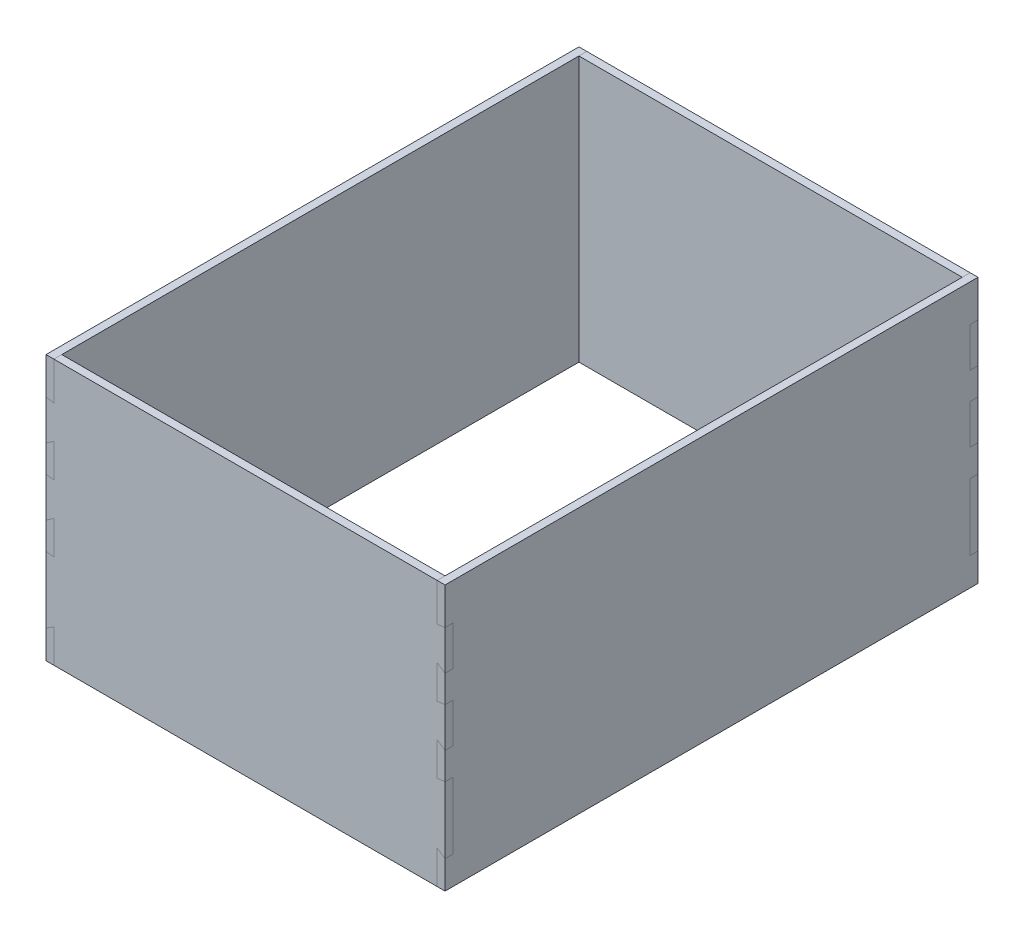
SolidWorks part; units mm, degrees
ref_plane "Front Plane" through (0, 0, 0) normal (0, 0, 1) x (1, 0, 0)
ref_plane "Top Plane" through (0, 0, 0) normal (0, 1, 0) x (1, 0, 0)
ref_plane "Right Plane" through (0, 0, 0) normal (1, 0, 0) x (0, 0, -1)
sketch "Sketch1" plane through (0, 0, 0) normal (0, 0, 1) x (1, 0, 0)
  line L1 (-132.5632, 48.0132) -> (-56.5632, 48.0132)
  line L2 (-132.5632, 48.0132) -> (-132.5632, -52.9868)
  line L3 (-132.5632, -52.9868) -> (-56.5632, -52.9868)
  line L4 (-56.5632, 48.0132) -> (-56.5632, -52.9868)
extrude "Boss-Extrude1" add sketch "Sketch1" along normal blind 3
sketch "Sketch2" plane through (0, 0, 3) normal (0, 0, 1) x (1, 0, 0)
  line L0 (-132.5632, 48.0132) -> (-129.5632, 48.0132)
  line L1 (-56.5632, 48.0132) -> (-132.5632, 48.0132) construction
  line L2 (-129.5632, 48.0132) -> (-129.5632, 33.5846)
  line L3 (-129.5632, 33.5846) -> (-132.5632, 33.9596)
  line L4 (-132.5632, 48.0132) -> (-132.5632, -52.9868) construction
  line L5 (-132.5632, 33.9596) -> (-132.5632, 48.0132)
  line L6 (-132.5632, 8.531) -> (-132.5632, 18.8703)
  line L7 (-129.5632, 20.8703) -> (-129.5632, 8.156)
  line L8 (-129.5632, 8.156) -> (-132.5632, 8.531)
  line L9 (-132.5632, 18.8703) -> (-129.5632, 20.8703)
  line L10 (-132.5632, -6.5583) -> (-129.5632, -4.5583)
  line L11 (-129.5632, -4.5583) -> (-129.5632, -17.2726)
  line L12 (-129.5632, -17.2726) -> (-132.5632, -16.8976)
  line L13 (-132.5632, -16.8976) -> (-132.5632, -6.5583)
  line L14 (-129.5632, 33.5846) -> (-137.5632, 33.5846) construction
  line L15 (-137.5632, 33.5846) -> (-137.5632, 34.5846) construction
  line L16 (-129.5632, 20.8703) -> (-131.0632, 20.8703) construction
  line L17 (-131.0632, 20.8703) -> (-131.0632, 19.8703) construction
  line L18 (-132.5632, -52.9868) -> (-132.5632, -42.2726)
  line L19 (-132.5632, -42.2726) -> (-129.5632, -40.2726)
  line L20 (-129.5632, -40.2726) -> (-129.5632, -52.9868)
  line L21 (-132.5632, -52.9868) -> (-56.5632, -52.9868) construction
  line L22 (-129.5632, -52.9868) -> (-132.5632, -52.9868)
  point P28 (0, 0)
  point P30 (0, 0)
extrude "Cut-Extrude3" cut sketch "Sketch2" against normal blind 15
sketch "Sketch3" plane through (0, 0, 3) normal (0, 0, 1) x (1, 0, 0)
  line L0 (-56.5632, 48.0132) -> (-129.5632, 48.0132) construction
  line L1 (-132.5632, 48.0132) -> (-129.5632, 48.0132)
  line L2 (-132.5632, 48.0132) -> (-132.5632, -52.9868)
  line L3 (-132.5632, -52.9868) -> (-129.5632, -52.9868)
  line L4 (-129.5632, 48.0132) -> (-129.5632, -52.9868)
  line L5 (-132.5632, 33.9596) -> (-132.5632, 18.8703) construction
  line L8 (-129.5632, -52.9868) -> (-56.5632, -52.9868) construction
extrude "Boss-Extrude3" add sketch "Sketch3" against normal blind 101.5 separate body
other "Intersect1"
combine bodies "Combine1" operation type add bodies to combine 108 111 107 110
mirror "Mirror1" about plane through (0, 0, -98.5) normal (0, 0, 1)
mirror "Mirror2" about plane through (-56.5632, 48.0132, -200) normal (-1, 0, 0)
combine bodies "Combine2" operation type add bodies to combine 109 114
combine bodies "Combine3" operation type add bodies to combine 116 117
combine bodies "Combine4" operation type add bodies to combine 115 113
combine bodies "Combine5" operation type add bodies to combine 118 112
equation "\"h\" = 101"
equation "\"l\" = 152"
equation "\"d\" = 203"
equation "\"m.t\" = 3"
equation "\"d.t\" = 1.5"
equation "\"D1@Sketch1\"=\"h\""
equation "\"D2@Sketch1\"=\"l\"/2"
equation "\"D1@Boss-Extrude1\"=\"m.t\""
equation "\"D1@Sketch2\"=\"m.t\""
equation "\"D2@Sketch2\"=\"h\"/7"
equation "\"D8@Sketch2\"=\"d.t\""
equation "\"D1@Sketch3\"=\"m.t\""
equation "\"D1@Boss-Extrude3\"=\"d\"/2"
